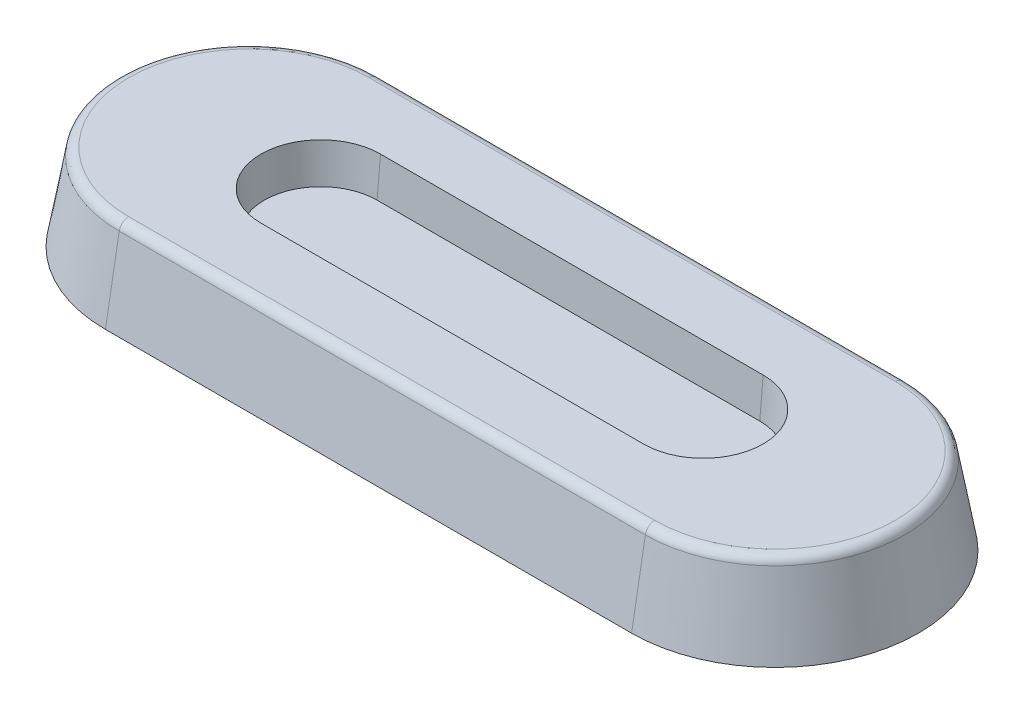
SolidWorks part; units mm, degrees
ref_plane "Front" through (0, 0, 0) normal (0, 0, 1) x (1, 0, 0)
ref_plane "Top" through (0, 0, 0) normal (0, 1, 0) x (1, 0, 0)
ref_plane "Right" through (0, 0, 0) normal (1, 0, 0) x (0, 0, -1)
sketch "Sketch2" plane through (0, 0, 0) normal (0, 1, 0) x (1, 0, 0)
  line L0 (55, 0) -> (-55, 0) construction
  line L1 (55, -30) -> (-55, -30)
  line L2 (55, 30) -> (-55, 30)
  arc A0 (55, -30) -> (55, 30) centre (55, 0) ccw
  arc A1 (-55, 30) -> (-55, -30) centre (-55, 0) ccw
  point P2 (0, 0)
  dimension "D1" = 60
  dimension "D2" = 110
extrude "Boss-Extrude1" add sketch "Sketch2" along normal blind 18 draft 10
sketch "Sketch3" plane through (0, 18, 0) normal (0, 1, 0) x (1, 0, 0)
  line L0 (40, 0) -> (-40, 0) construction
  line L1 (40, -12.5) -> (-40, -12.5)
  line L2 (40, 12.5) -> (-40, 12.5)
  arc A0 (40, -12.5) -> (40, 12.5) centre (40, 0) ccw
  arc A1 (-40, 12.5) -> (-40, -12.5) centre (-40, 0) ccw
  point P2 (0, 0)
  dimension "D1" = 25
  dimension "D2" = 80
extrude "Cut-Extrude1" cut sketch "Sketch3" against normal blind 8 draft 5
fillet "Fillet1" radius 2 4 edges at (81.8261, 18, 0) (0, 18, 26.8261) (-81.8261, 18, 0) (0, 18, -26.8261)
shell "Shell1" thickness 2
ref_plane "Plane1" through (0, 5, 0) normal (0, 1, 0) x (1, 0, 0)
sketch "Sketch4" plane through (0, 5, 0) normal (0, 1, 0) x (1, 0, 0)
  line L0 (-16.148, -27.9691) -> (16.148, 27.9691)
  line L1 (-55, -27.9691) -> (55, -27.9691) construction
  line L2 (55, 27.9691) -> (-55, 27.9691) construction
  line L3 (0, 0) -> (0, -27.9691) construction
  dimension "D1" = 30
rib "Rib2" sketch "Sketch4" sketch "Sketch4" thickness 1.5 extrusion direction normal to sketch draft on yes draft angle 1 parameters "D1"=1.5, "D3"=1
pattern_linear "LPattern1" count 4 spacing 19.9186 along (0.866, 0, 0.5) of "Rib2"
pattern_linear "LPattern2" count 4 spacing 19.9186 along (-0.866, 0, -0.5) of "Rib2"
mirror "Mirror1" about plane through (0, 0, 0) normal (1, 0, 0) of "Rib2", "LPattern2", "LPattern1"
